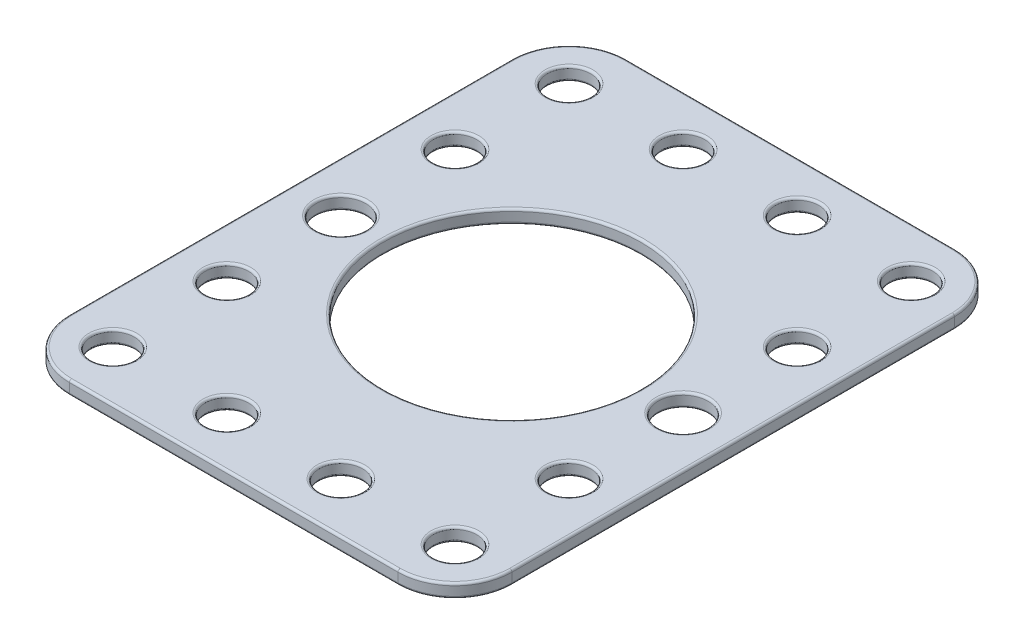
SolidWorks part; units mm, degrees
ref_plane "Front" through (0, 0, 0) normal (0, 0, 1) x (1, 0, 0)
ref_plane "Top" through (0, 0, 0) normal (0, 1, 0) x (1, 0, 0)
ref_plane "Right" through (0, 0, 0) normal (1, 0, 0) x (0, 0, -1)
sketch "Sketch1" plane through (0, 0, 0) normal (0, 1, 0) x (1, 0, 0)
  line L1 (6.35, 0) -> (42.926, 0)
  line L2 (0, 6.35) -> (0, 55.626)
  line L3 (6.35, 61.976) -> (42.926, 61.976)
  line L4 (49.276, 6.35) -> (49.276, 55.626)
  arc A0 (0, 55.626) -> (6.35, 61.976) centre (6.35, 55.626) cw
  arc A1 (42.926, 61.976) -> (49.276, 55.626) centre (42.926, 55.626) cw
  arc A2 (42.926, 0) -> (49.276, 6.35) centre (42.926, 6.35) ccw
  arc A3 (6.35, 0) -> (0, 6.35) centre (6.35, 6.35) cw
  circle A4 centre (5.588, 30.988) radius 2.7686
  circle A5 centre (43.688, 30.988) radius 2.7686
  circle A7 centre (24.638, 30.988) radius 14.351
  point P6 (0, 61.976)
  point P9 (49.276, 61.976)
  point P14 (0, 0)
  dimension "D3" = 6.35
  dimension "D6" = 19.05
  dimension "D15" = 28.702
  dimension "D4" = 5.5372
  dimension "D1" = 49.276
  dimension "D2" = 61.976
  dimension "D5" = 38.1
  dimension "D13" = 30.988
  dimension "D14" = 24.638
extrude "Extrude1" add sketch "Sketch1" along normal blind 1.524
sketch "Sketch2" plane through (0, 1.524, 0) normal (0, 1, 0) x (-1, 0, 0)
  line L0 (0, -55.626) -> (0, -6.35) construction
  line L1 (-42.926, -61.976) -> (-6.35, -61.976) construction
  circle A0 centre (-5.588, -56.388) radius 2.413
  dimension "D2" = 4.826
  dimension "D1" = 5.588
  dimension "D3" = 5.588
extrude "Cut-Extrude1" cut sketch "Sketch2" against normal through all
pattern_linear "LPattern1" count 4 spacing 12.7 along (1, 0, 0) of "Cut-Extrude1"
pattern_linear "LPattern2" count 5 spacing 12.7 along (0, 0, 1) of "Cut-Extrude1"
sketch "Sketch3" plane through (0, 1.524, 0) normal (0, 1, 0) x (-1, 0, 0)
  line L0 (-49.276, -6.35) -> (-49.276, -55.626) construction
  line L1 (-6.35, 0) -> (-42.926, 0) construction
  circle A0 centre (-43.688, -5.588) radius 2.413
  circle A1 centre (-5.588, -56.388) radius 2.413 construction
  dimension "D1" = 5.588
  dimension "D2" = 5.588
extrude "Cut-Extrude2" cut sketch "Sketch3" against normal through all
pattern_linear "LPattern3" count 4 spacing 12.7 along (0, 0, -1) of "Cut-Extrude2"
pattern_linear "LPattern4" count 3 spacing 12.7 along (-1, 0, 0) of "Cut-Extrude2"
fillet "Fillet1" radius 0.254 46 edges at (1.8599, 1.524, -1.8599) (24.638, 1.524, 0) (47.4161, 1.524, -1.8599) (49.276, 1.524, -30.988) (5.588, 0, -28.2194) (5.588, 1.524, -28.2194) (47.4161, 1.524, -60.1161) (43.688, 0, -28.2194) (43.688, 1.524, -28.2194) (24.638, 1.524, -61.976) (24.638, 0, -16.637) (24.638, 1.524, -16.637) (5.588, 0, -53.975) (5.588, 1.524, -53.975) (1.8599, 1.524, -60.1161) (18.288, 0, -53.975) (18.288, 1.524, -53.975) (30.988, 0, -53.975) (30.988, 1.524, -53.975) (43.688, 0, -53.975) (43.688, 1.524, -53.975) (5.588, 0, -41.275) (5.588, 1.524, -41.275) (5.588, 0, -15.875) (5.588, 1.524, -15.875) (5.588, 0, -3.175) (5.588, 1.524, -3.175) (43.688, 0, -3.175) (43.688, 1.524, -3.175) (24.638, 0, -61.976) (0, 1.524, -30.988) (43.688, 0, -15.875) (43.688, 1.524, -15.875) (47.4161, 0, -60.1161) (43.688, 0, -41.275) (43.688, 1.524, -41.275) (49.276, 0, -30.988) (30.988, 1.524, -3.175) (30.988, 0, -3.175) (47.4161, 0, -1.8599) (18.288, 0, -3.175) (18.288, 1.524, -3.175) (24.638, 0, 0) (1.8599, 0, -1.8599) (0, 0, -30.988) (1.8599, 0, -60.1161)
